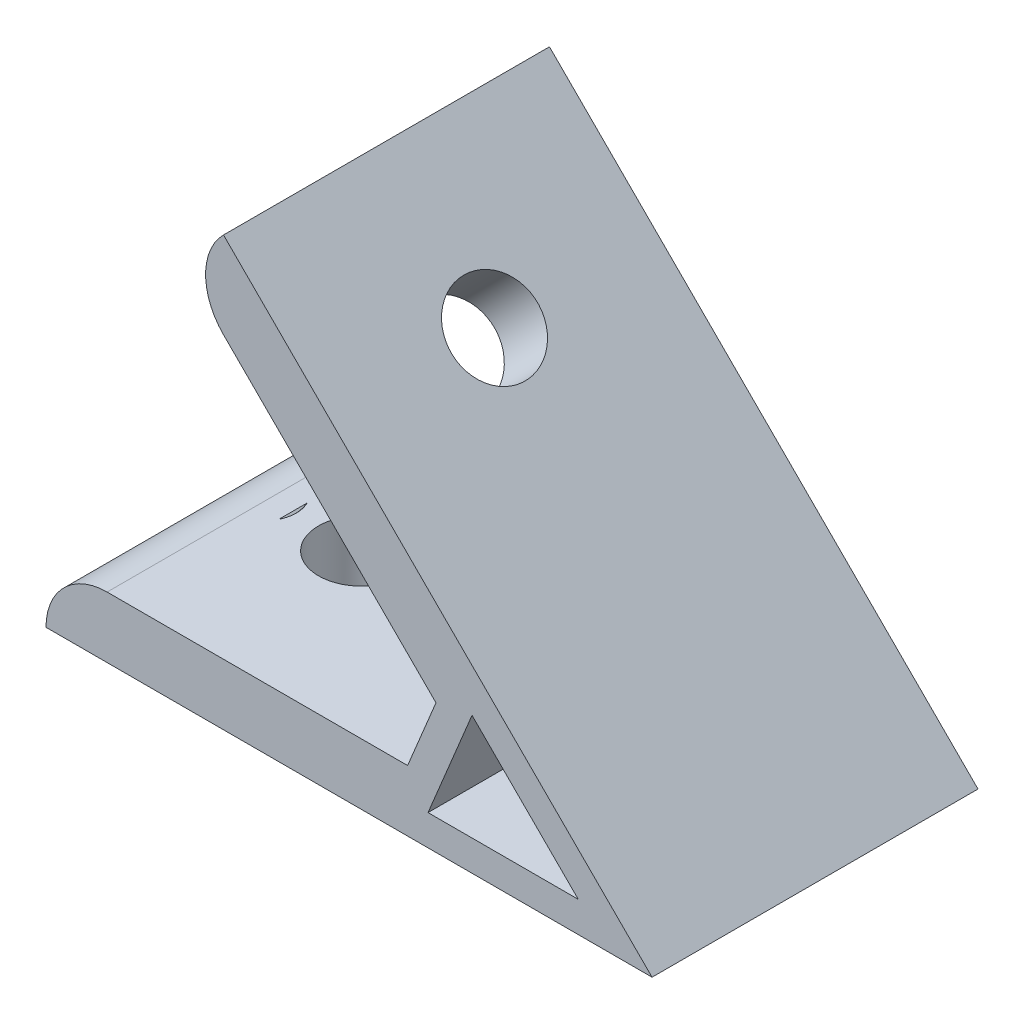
SolidWorks part; units mm, degrees
ref_plane "前视基准面" through (0, 0, 0) normal (0, 0, 1) x (1, 0, 0)
ref_plane "上视基准面" through (0, 0, 0) normal (0, 1, 0) x (1, 0, 0)
ref_plane "右视基准面" through (0, 0, 0) normal (1, 0, 0) x (0, 0, -1)
sketch "草图1" plane through (0, 0, 0) normal (0, 0, 1) x (1, 0, 0)
  line L0 (0, 0) -> (59.5, 0)
  line L1 (59.5, 0) -> (17.4271, 42.0729)
  line L2 (17.4271, 42.0729) -> (13.1845, 37.8302)
  line L3 (13.1845, 37.8302) -> (38.2868, 12.7279)
  line L4 (38.2868, 12.7279) -> (35.5, 6)
  line L5 (35.5, 6) -> (0, 6)
  line L6 (0, 6) -> (0, 0)
  dimension "D1" = 45
  dimension "D2" = 59.5
  dimension "D3" = 59.5
  dimension "D4" = 6
  dimension "D5" = 6
  dimension "D6" = 35.5
  dimension "D7" = 35.5
  dimension "D8" = 7.2823
extrude "凸台-拉伸1" add sketch "草图1" along normal mid plane 32
sketch "草图2" plane through (0, 0, 16) normal (0, 0, 1) x (1, 0, 0)
  line L0 (41.8255, 13.4318) -> (37.5045, 3)
  line L1 (41.8255, 13.4318) -> (52.2574, 3)
  line L2 (52.2574, 3) -> (37.5045, 3)
  line L4 (0, 0) -> (59.5, 0) construction
  line L5 (59.5, 0) -> (17.4271, 42.0729) construction
  line L7 (38.2868, 12.7279) -> (35.5, 6) construction
  dimension "D1" = 45
  dimension "D2" = 45
  dimension "D3" = 3
  dimension "D4" = 3
  dimension "D5" = 67.5
  dimension "D6" = 67.5
  dimension "D7" = 3
  dimension "D8" = 3
extrude "切除-拉伸1" cut sketch "草图2" against normal through all
fillet "圆角1" radius 6 1 edges at (13.1845, 37.8302, 0)
fillet "圆角2" radius 6 1 edges at (0, 6, 0)
sketch "草图3" plane through (29.75, 29.75, 0) normal (0.7071, 0.7071, 0) x (0, 0, -1)
  line L0 (-16, 17.4271) -> (16, 17.4271) construction
  line L2 (16, -42.0729) -> (16, 17.4271) construction
  circle A0 centre (0, 2.4271) radius 4.25
  dimension "D1" = 8.5
  dimension "D2" = 15
  dimension "D3" = 16
extrude "切除-拉伸2" cut sketch "草图3" against normal blind 32
ref_plane "基准面1" through (8.7136, 21.0364, 0) normal (0.3827, 0.9239, 0) x (-0.9239, 0.3827, 0)
mirror "镜向1" about plane through (8.7136, 21.0364, 0) normal (0.3827, 0.9239, 0) of "切除-拉伸2"
